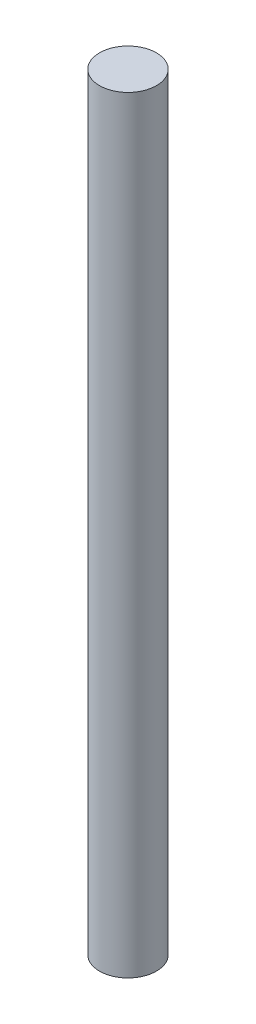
SolidWorks part; units mm, degrees
ref_plane "Front Plane" through (0, 0, 0) normal (0, 0, 1) x (1, 0, 0)
ref_plane "Top Plane" through (0, 0, 0) normal (0, 1, 0) x (1, 0, 0)
ref_plane "Right Plane" through (0, 0, 0) normal (1, 0, 0) x (0, 0, -1)
sketch "Sketch1" plane through (0, 0, 0) normal (0, 0, 1) x (1, 0, 0)
  line L0 (0, 0) -> (-6, 0)
  line L1 (-6, 0) -> (-6, 161.7)
  line L2 (-6, 161.7) -> (0, 161.7)
  line L3 (0, 161.7) -> (0, 0)
  line L4 (6, 0) -> (6, 161.7) construction
  line L5 (0, 161.7) -> (6, 161.7) construction
  line L6 (0, 0) -> (6, 0) construction
  line L7 (-1006, 80.85) -> (48994, 80.85) construction
  point P10 (-6, 80.85)
revolve "Revolve1" add sketch "Sketch1" angle 360 about L3
equation "\"ShaftDiameter\"= 12mm"
equation "\"D1@Sketch1\" = \"ShaftDiameter\""
equation "\"PendulumDiameter\"=12mm"
equation "\"PendulumLength\"= 140mm"
equation "\"EncoderOuterDiameter\"=1.5"
equation "\"EncoderShaftDiameter\"= 6mm"
equation "\"EncoderShaftLength\"=15mm+.5in+3mm"
equation "\"PendulumHolderangle\"=60"
equation "\"PendulumholderBottomHeight\"= 75"
equation "\"PendulumholderBottomWidth\"= 75"
equation "\"PendulumholderHeight\"=25"
equation "\"BearingOutsideDiameter\"=21mm"
equation "\"PendulumHolderWidth\"= 100mm"
equation "\"ShaftHeightFromTSlot\"= 100mm"
equation "\"BearingThickness\"= 5mm"
equation "\"SlipRingOuterDiameter\"=56mm"
equation "\"SlipringBigThickness\"=25mm"
equation "\"SlipringSmallThickness\"=8.5mm"
equation "\"Tol\"=2mm"
equation "\"ScrewHole\"= 5mm"
equation "\"Tframwidth\"= 40mm"
equation "\"TFrameheight\"= 12in"
equation "\"Tframetotalwidth\"= 2ft"
equation "\"TFramethickness\"= 6in"
equation "\"D2@Sketch1\"=\"TFramethickness\"-\"EncoderShaftLength\"+\"Tframwidth\""
